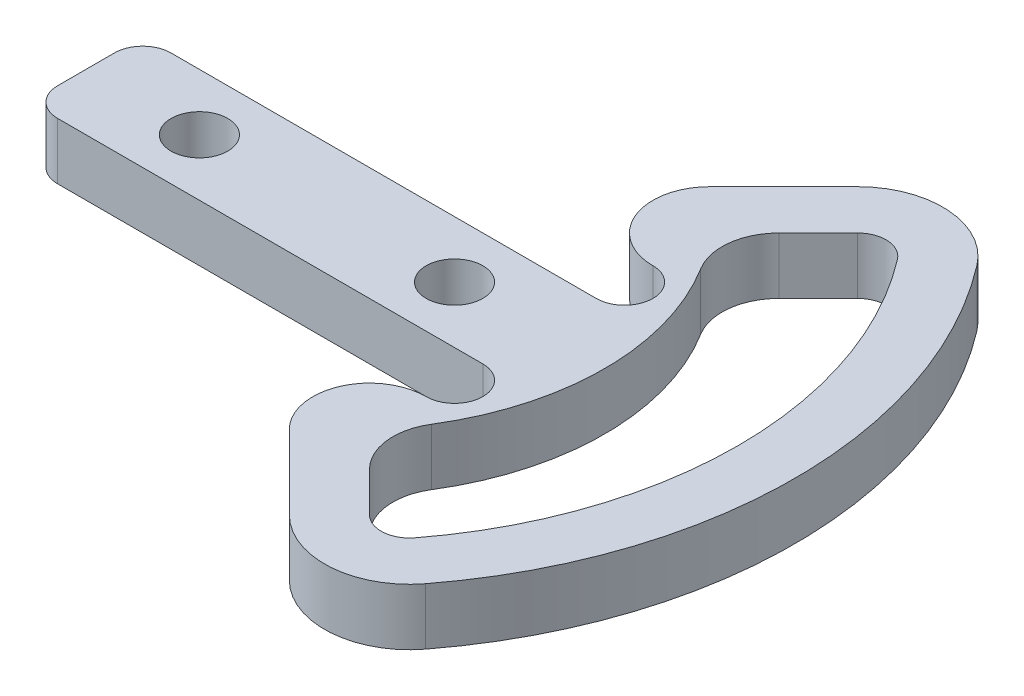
SolidWorks part; units mm, degrees
ref_plane "Front Plane" through (0, 0, 0) normal (0, 0, 1) x (1, 0, 0)
ref_plane "Top Plane" through (0, 0, 0) normal (0, 1, 0) x (1, 0, 0)
ref_plane "Right Plane" through (0, 0, 0) normal (1, 0, 0) x (0, 0, -1)
sketch "Sketch1" plane through (0, 0, 0) normal (0, 1, 0) x (1, 0, 0)
  line L0 (0, 0) -> (140.0582, 0) construction
  line L1 (0, -5) -> (0, 5)
  line L2 (5, 10) -> (80, 10)
  line L3 (72.9289, 37.0711) -> (85.9929, 50.135)
  line L4 (86.102, 36.102) -> (93.0639, 43.0639)
  line L5 (86.102, -36.102) -> (93.0639, -43.0639)
  line L6 (72.9289, -37.0711) -> (85.9929, -50.135)
  line L7 (5, -10) -> (80, -10)
  line L8 (80, 30) -> (93.0639, 43.0639) construction
  arc A0 (0, 5) -> (5, 10) centre (5, 5) cw
  arc A1 (80, 10) -> (80, 20) centre (80, 15) ccw
  arc A2 (80, 20) -> (72.9289, 37.0711) centre (80, 30) cw
  arc A3 (85.9929, 50.135) -> (108.507, 48.6503) centre (96.5995, 39.5284) cw
  arc A4 (108.507, 48.6503) -> (108.507, -48.6503) centre (45, 0) cw
  circle A5 centre (20, 0) radius 5
  arc A6 (93.0639, 43.0639) -> (100.5687, 42.569) centre (96.5995, 39.5284) cw
  arc A7 (100.5687, 42.569) -> (100.5687, -42.569) centre (45, 0) cw
  arc A8 (93.0639, -43.0639) -> (100.5687, -42.569) centre (96.5995, -39.5284) ccw
  arc A9 (85.9929, -50.135) -> (108.507, -48.6503) centre (96.5995, -39.5284) ccw
  arc A10 (80, -20) -> (72.9289, -37.0711) centre (80, -30) ccw
  arc A11 (80, -10) -> (80, -20) centre (80, -15) cw
  arc A12 (0, -5) -> (5, -10) centre (5, -5) ccw
  arc A13 (84.6796, 23.7526) -> (84.6796, -23.7526) centre (46.459, 0) cw
  arc A14 (84.6796, 23.7526) -> (86.102, 36.102) centre (93.1731, 29.0309) cw
  arc A15 (86.102, -36.102) -> (84.6796, -23.7526) centre (93.1731, -29.0309) cw
  arc A16 (80, 30) -> (80, 30) centre (80, 30) cw construction
  circle A17 centre (65, 0) radius 5
  dimension "D3" = 5
  dimension "D4" = 10
  dimension "D5" = 15
  dimension "D7" = 5
  dimension "D9" = 80
  dimension "D10" = 45
  dimension "D11" = 10
  dimension "D12" = 10
  dimension "D1" = 10
  dimension "D2" = 90
  dimension "D6" = 45
  dimension "D8" = 80
  dimension "D13" = 90
  dimension "D14" = 20
  dimension "D15" = 45
extrude "Extrude1" add sketch "Sketch1" along normal mid plane 10
